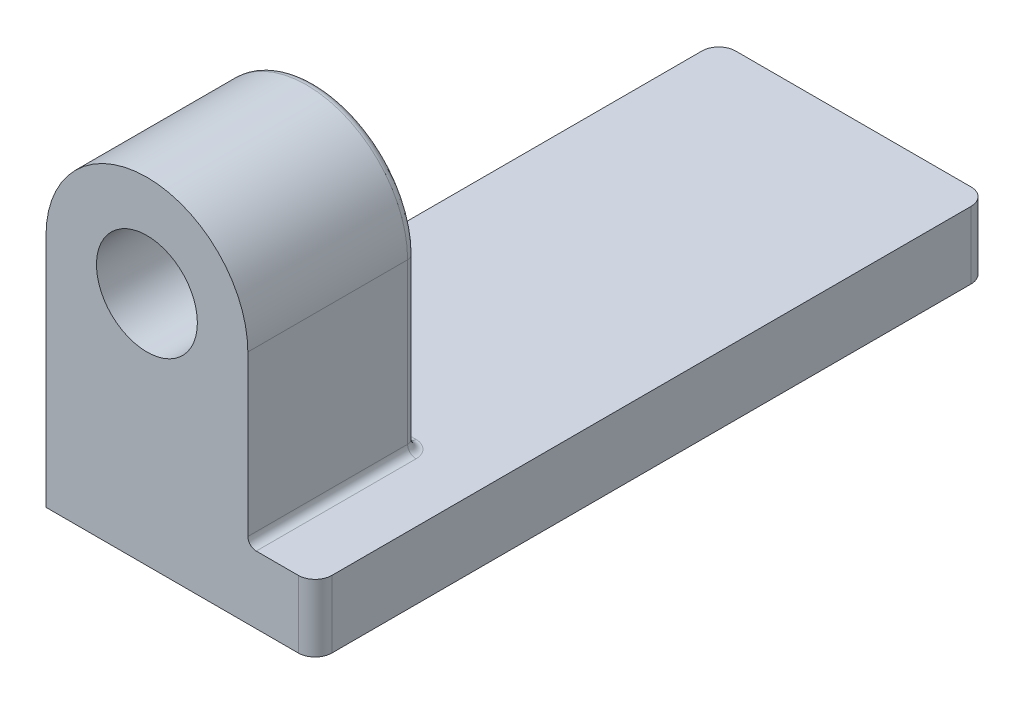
SolidWorks part; units mm, degrees
ref_plane "Front" through (0, 0, 0) normal (0, 0, 1) x (1, 0, 0)
ref_plane "Top" through (0, 0, 0) normal (0, 1, 0) x (1, 0, 0)
ref_plane "Right" through (0, 0, 0) normal (1, 0, 0) x (0, 0, -1)
sketch "Sketch1" plane through (0, 0, 0) normal (0, 0, 1) x (1, 0, 0)
  line L0 (0, 0) -> (50.8, 0)
  line L1 (0, 0) -> (0, 12.7)
  line L2 (50.8, 12.7) -> (0, 12.7)
  line L3 (50.8, 12.7) -> (50.8, 0)
  dimension "D1" = 50.8
  dimension "D2" = 12.7
extrude "Base-Extrude" add sketch "Sketch1" along normal blind 127
sketch "Sketch2" plane through (0, 0, 127) normal (0, 0, 1) x (1, 0, 0)
  line L0 (0, 12.7) -> (0, 44.45)
  line L1 (38.1, 44.45) -> (38.1, 12.7)
  line L2 (50.8, 12.7) -> (0, 12.7) construction
  line L3 (38.1, 12.7) -> (0, 12.7)
  arc A0 (0, 44.45) -> (38.1, 44.45) centre (19.05, 44.45) cw
  dimension "D1" = 38.1
  dimension "D2" = 50.8
extrude "Boss-Extrude1" add sketch "Sketch2" against normal blind 31.75
sketch "Sketch3" plane through (0, 0, 127) normal (0, 0, 1) x (1, 0, 0)
  circle A0 centre (19.05, 44.45) radius 9.525
  dimension "D1" = 19.05
extrude "Cut-Extrude1" cut sketch "Sketch3" against normal through all
fillet "Fillet1" radius 3.175 4 edges at (50.8, 6.35, 127) (50.8, 6.35, 0) (0, 6.35, 0)
fillet "Fillet2" radius 1.5875 5 edges at (19.05, 63.5, 95.25) (38.1, 28.575, 95.25)
fillet "Fillet3" radius 1.5875 5 edges at (0.465, 12.7, 95.715) (37.635, 12.7, 95.715)
